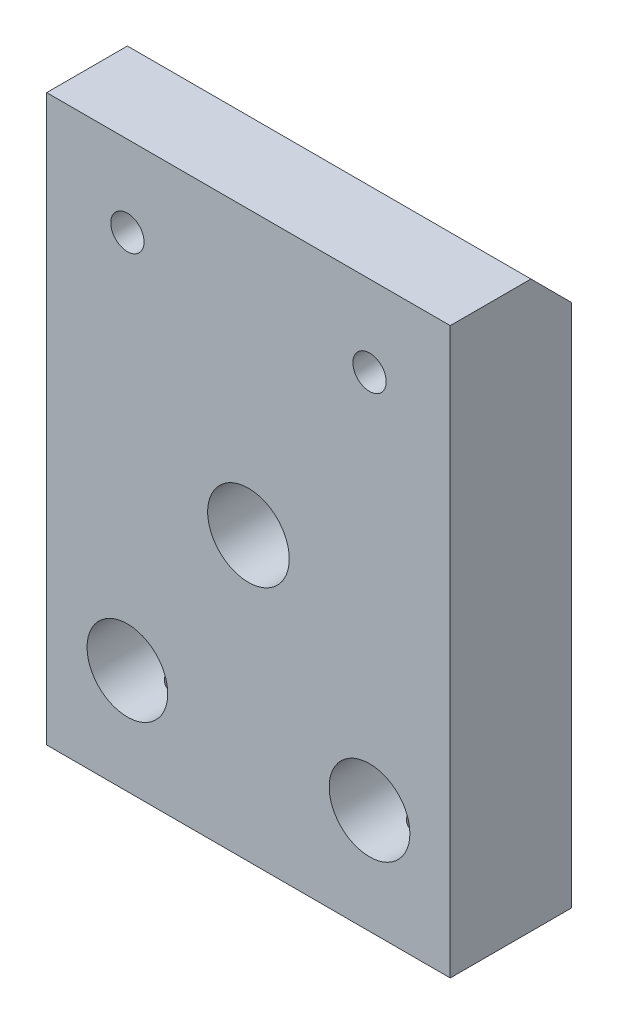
SolidWorks part; units mm, degrees
ref_plane "Plan1" through (0, 0, 0) normal (0, 0, 1) x (1, 0, 0)
ref_plane "plan2" through (0, 0, 0) normal (0, 1, 0) x (1, 0, 0)
ref_plane "Plan3" through (0, 0, 0) normal (1, 0, 0) x (0, 0, -1)
sketch "Esquisse1" plane through (0, 0, 0) normal (0, 0, 1) x (1, 0, 0)
  line L0 (0, 0) -> (0, 105) construction
  line L1 (-25, 0) -> (25, 0)
  line L2 (25, 0) -> (25, 70)
  line L3 (-25, 0) -> (-25, 70)
  line L4 (25, 70) -> (-25, 70)
  circle A0 centre (15, 13) radius 5
  circle A1 centre (-15, 13) radius 5
  circle A2 centre (0, 35) radius 5.055
  circle A3 centre (-15, 60) radius 2.065
  circle A4 centre (15, 60) radius 2.065
  point P5 (0, 0)
  point P9 (0, 70)
  dimension "D8" = 4.13
  dimension "D9" = 10
  dimension "D10" = 10.11
  dimension "D1" = 50
  dimension "D2" = 70
  dimension "D3" = 13
  dimension "D4" = 10
  dimension "D5" = 10
  dimension "D6" = 35
  dimension "D7" = 60
extrude "Base-Extrusion" add sketch "Esquisse1" along normal blind 15
chamfer "Chanfrein3" distance 5 angle 45
sketch "Esquisse2" plane through (0, 0, 0) normal (0, -1, 0) x (1, 0, 0)
  line L0 (0, 16.5759) -> (0, -4.0673) construction
  line L1 (0, 15) -> (0, 0) construction
  line L2 (15, 15) -> (15, 0) construction
  line L3 (25, 15) -> (25, 0) construction
  line L5 (-25, 0) -> (25, 0) construction
  circle A0 centre (15, 7.5) radius 2.065
  circle A1 centre (-15, 7.5) radius 2.065
  dimension "D3" = 4.13
  dimension "D1" = 10
  dimension "D2" = 7.5
extrude "Enlèv. mat.-Extru.1" cut sketch "Esquisse2" against normal up to next
